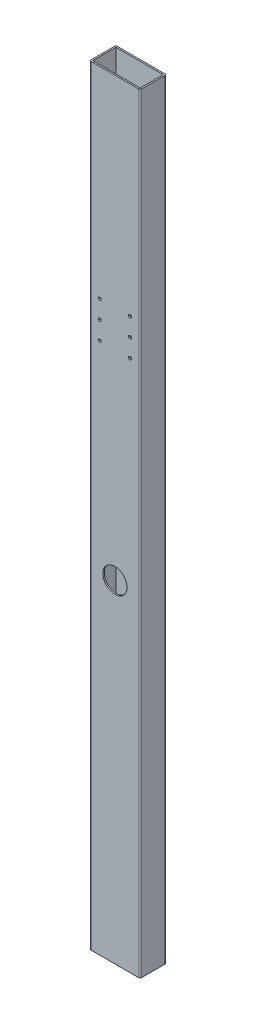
SolidWorks part; units mm, degrees
ref_plane "Front Plane" through (0, 0, 0) normal (0, 0, 1) x (1, 0, 0)
ref_plane "Top Plane" through (0, 0, 0) normal (0, 1, 0) x (1, 0, 0)
ref_plane "Right Plane" through (0, 0, 0) normal (1, 0, 0) x (0, 0, -1)
sketch "Sketch1" plane through (0, 0, 0) normal (0, 1, 0) x (1, 0, 0)
  line L1 (-24.8285, -13.716) -> (24.8285, -13.716)
  line L2 (-26.416, -12.1285) -> (-26.416, 12.1285)
  line L3 (-24.8285, 13.716) -> (24.8285, 13.716)
  line L4 (26.416, -12.1285) -> (26.416, 12.1285)
  line L5 (-26.416, -13.716) -> (26.416, 13.716) construction
  line L6 (-26.416, 13.716) -> (26.416, -13.716) construction
  arc A0 (-24.8285, -13.716) -> (-26.416, -12.1285) centre (-24.8285, -12.1285) cw
  arc A1 (24.8285, -13.716) -> (26.416, -12.1285) centre (24.8285, -12.1285) ccw
  arc A2 (24.8285, 13.716) -> (26.416, 12.1285) centre (24.8285, 12.1285) cw
  arc A3 (-26.416, 12.1285) -> (-24.8285, 13.716) centre (-24.8285, 12.1285) cw
  point P0 (0, 0)
  dimension "D3" = 1.5875
  dimension "D1" = 52.832
  dimension "D2" = 27.432
extrude "Extrude-Thin1" add sketch "Sketch1" along normal blind 589.28 thin
sketch "Sketch2" plane through (0, 0, 13.716) normal (0, 0, 1) x (1, 0, 0)
  line L0 (-24.8285, 589.28) -> (24.8285, 589.28) construction
  circle A0 centre (0, 347.98) radius 12.7
  point P5 (0, 589.28)
  dimension "D1" = 25.4
  dimension "D2" = 241.3
extrude "Cut-Extrude1" cut sketch "Sketch2" against normal through all
sketch "Sketch4" plane through (0, 589.28, 0) normal (0, 1, 0) x (1, 0, 0)
  line L0 (24.8285, -12.1285) -> (24.8285, 12.1285) construction
  line L1 (-24.8285, -12.1285) -> (24.8285, -12.1285) construction
  line L2 (24.8285, 12.1285) -> (-24.8285, 12.1285) construction
  line L3 (-24.8285, 12.1285) -> (-24.8285, -12.1285) construction
  line L4 (-24.8285, -13.716) -> (24.8285, -13.716)
  line L5 (26.416, -12.1285) -> (26.416, 12.1285)
  line L6 (24.8285, 13.716) -> (-24.8285, 13.716)
  line L7 (-26.416, 12.1285) -> (-26.416, -12.1285)
  line L8 (-24.8285, -13.716) -> (24.8285, -13.716)
  line L9 (26.416, -12.1285) -> (26.416, 12.1285)
  line L10 (24.8285, 13.716) -> (-24.8285, 13.716)
  line L11 (-26.416, 12.1285) -> (-26.416, -12.1285)
  line L12 (24.8285, -12.1285) -> (24.8285, 12.1285)
  line L13 (-24.8285, -12.1285) -> (24.8285, -12.1285)
  line L14 (24.8285, 12.1285) -> (-24.8285, 12.1285)
  line L15 (-24.8285, 12.1285) -> (-24.8285, -12.1285)
  arc A4 (-26.416, -12.1285) -> (-24.8285, -13.716) centre (-24.8285, -12.1285) ccw
  arc A5 (24.8285, -13.716) -> (26.416, -12.1285) centre (24.8285, -12.1285) ccw
  arc A6 (26.416, 12.1285) -> (24.8285, 13.716) centre (24.8285, 12.1285) ccw
  arc A7 (-24.8285, 13.716) -> (-26.416, 12.1285) centre (-24.8285, 12.1285) ccw
  arc A8 (-26.416, -12.1285) -> (-24.8285, -13.716) centre (-24.8285, -12.1285) ccw
  arc A9 (24.8285, -13.716) -> (26.416, -12.1285) centre (24.8285, -12.1285) ccw
  arc A10 (26.416, 12.1285) -> (24.8285, 13.716) centre (24.8285, 12.1285) ccw
  arc A11 (-24.8285, 13.716) -> (-26.416, 12.1285) centre (-24.8285, 12.1285) ccw
  dimension "D1" = 0
extrude "Boss-Extrude1" add sketch "Sketch4" along normal blind 217.17
sketch "Sketch3" plane through (0, 0, 13.716) normal (0, 0, 1) x (1, 0, 0)
  circle A0 centre (15.875, 576.58) radius 1.5875
  circle A1 centre (15.875, 557.53) radius 1.5875
  circle A2 centre (-15.875, 576.58) radius 1.5875
  circle A3 centre (-15.875, 557.53) radius 1.5875
  circle A4 centre (-15.875, 595.63) radius 1.5875
  circle A5 centre (15.875, 595.63) radius 1.5875
extrude "Cut-Extrude2" cut sketch "Sketch3" against normal through all
